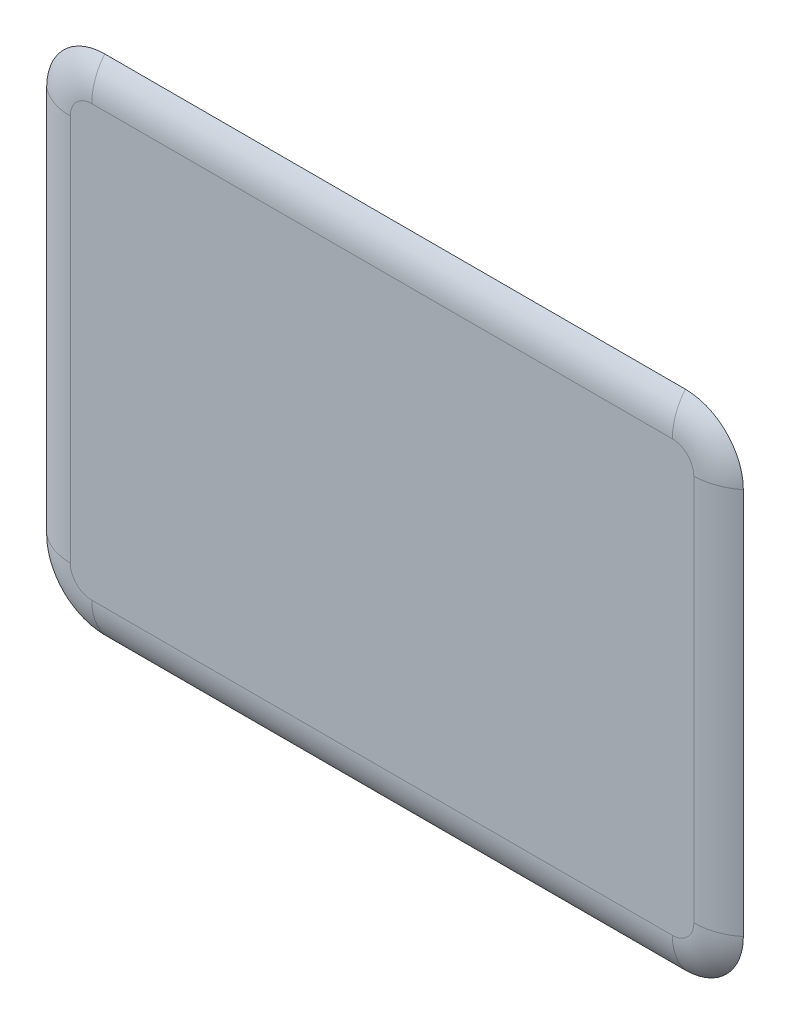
SolidWorks part; units mm, degrees
ref_plane "Plan de face" through (0, 0, 0) normal (0, 0, 1) x (1, 0, 0)
ref_plane "Plan de dessus" through (0, 0, 0) normal (0, 1, 0) x (1, 0, 0)
ref_plane "Plan de droite" through (0, 0, 0) normal (1, 0, 0) x (0, 0, -1)
sketch "Esquisse1" plane through (0, 0, 0) normal (0, 0, 1) x (1, 0, 0)
  line L1 (-75, 65) -> (75, 65)
  line L2 (-90, 50) -> (-90, -50)
  line L3 (-75, -65) -> (75, -65)
  line L4 (90, 50) -> (90, -50)
  arc A0 (75, -65) -> (90, -50) centre (75, -50) ccw
  arc A1 (-90, -50) -> (-75, -65) centre (-75, -50) ccw
  arc A2 (-75, 65) -> (-90, 50) centre (-75, 50) ccw
  arc A3 (75, 65) -> (90, 50) centre (75, 50) cw
  dimension "D5" = 15
  dimension "D1" = 130
  dimension "D2" = 180
  dimension "D3" = 90
  dimension "D4" = 65
extrude "Ballast p-v" add sketch "Esquisse1" along normal blind 3.35
fillet "Congé3" radius 15 8 edges at (85.6066, 60.6066, 3.35) (90, 0, 3.35) (85.6066, -60.6066, 3.35) (0, -65, 3.35) (-85.6066, -60.6066, 3.35) (-90, 0, 3.35) (-85.6066, 60.6066, 3.35) (0, 65, 3.35)
